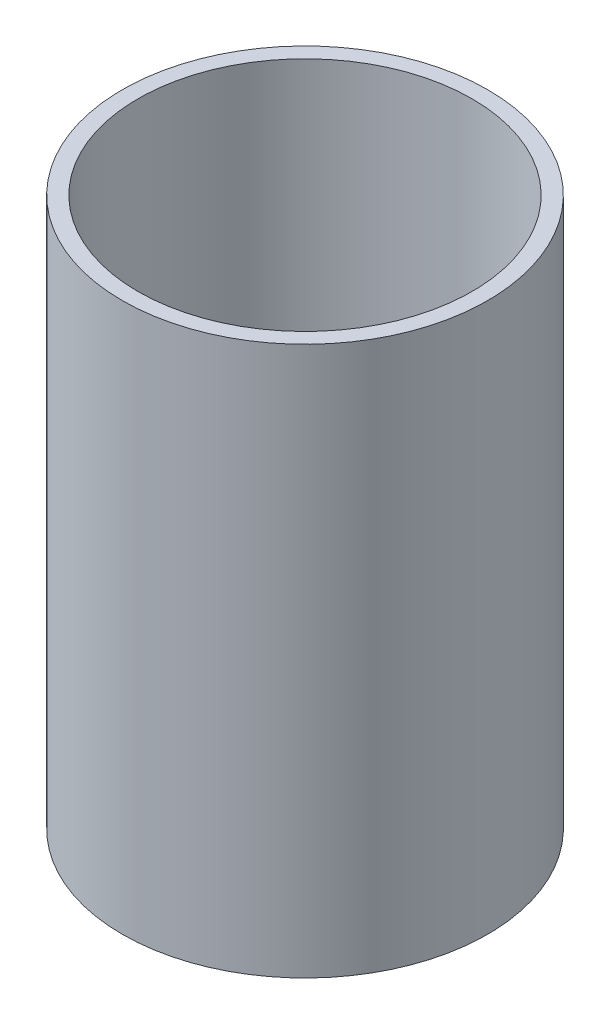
SolidWorks part; units mm, degrees
ref_plane "Front Plane" through (0, 0, 0) normal (0, 0, 1) x (1, 0, 0)
ref_plane "Top Plane" through (0, 0, 0) normal (0, 1, 0) x (1, 0, 0)
ref_plane "Right Plane" through (0, 0, 0) normal (1, 0, 0) x (0, 0, -1)
sketch "Sketch1" plane through (0, 0, 0) normal (0, 1, 0) x (0.9991, 0, -0.0422)
  circle A0 centre (28.5429, 18.9571) radius 10.65
  circle A1 centre (28.5429, 18.9571) radius 11.65
  dimension "D1" = 1
extrude "Boss-Extrude1" add sketch "Sketch1" along normal blind 35
